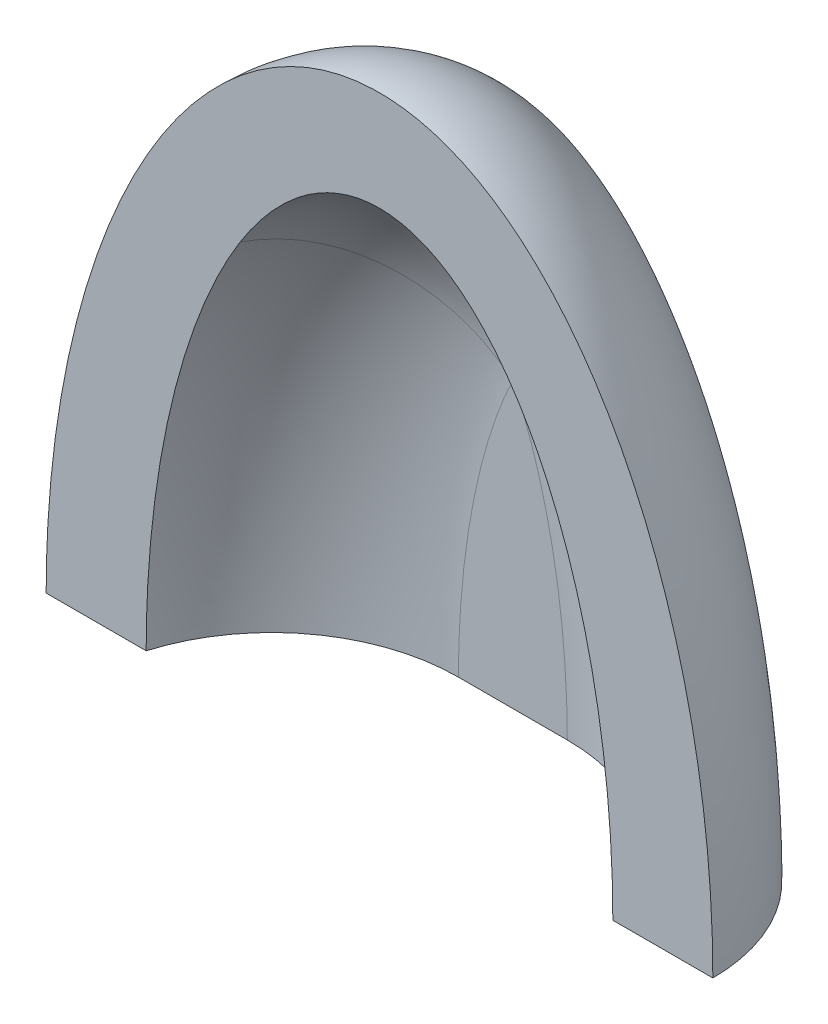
SolidWorks part; units mm, degrees
ref_plane "前视基准面" through (0, 0, 0) normal (0, 0, 1) x (1, 0, 0)
ref_plane "上视基准面" through (0, 0, 0) normal (0, 1, 0) x (1, 0, 0)
ref_plane "右视基准面" through (0, 0, 0) normal (1, 0, 0) x (0, 0, -1)
sketch "草图1" plane through (0, 0, 0) normal (0, 0, 1) x (1, 0, 0)
  line L0 (50, 0) -> (-50, 0)
  ellipse E0 centre (0, 0) end of major axis (0, 90) minor radius 50 (-50, 0) -> (50, 0) cw
extrude "凸台-拉伸1" add sketch "草图1" against normal blind 25
sketch "草图2" plane through (0, 0, 0) normal (0, 0, 1) x (1, 0, 0)
  line L0 (-50, 0) -> (50, 0) construction
  line L1 (-35, 0) -> (35, 0)
  ellipse E0 centre (0, 0) end of major axis (0, 75) minor radius 35 (-35, 0) -> (35, 0) cw
extrude "切除-拉伸1" cut sketch "草图2" against normal blind 20
fillet "圆角1" radius 28 1 edges at (0, 75, -20)
fillet "圆角2" radius 25 1 edges at (0, 90, -25)
